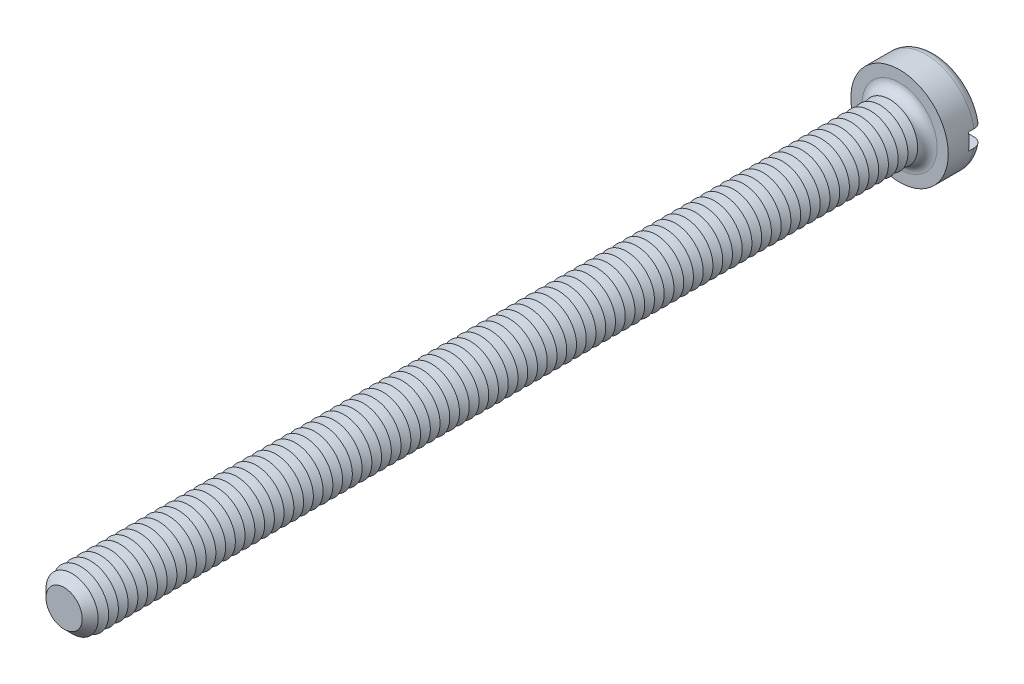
SolidWorks part; units mm, degrees
ref_plane "Front Plane" through (0, 0, 0) normal (0, 0, 1) x (1, 0, 0)
ref_plane "Top Plane" through (0, 0, 0) normal (0, 1, 0) x (1, 0, 0)
ref_plane "Right Plane" through (0, 0, 0) normal (1, 0, 0) x (0, 0, -1)
sketch "Sketch3" plane through (0, 0, 0) normal (0, 0, 1) x (1, 0, 0)
  circle A0 centre (0, 0) radius 3.5
  dimension "D1" = 7
extrude "Boss-Extrude2" add sketch "Sketch3" against normal blind 2.6
sketch "Sketch4" plane through (0, 0, 0) normal (0, 0, 1) x (1, 0, 0)
  circle A0 centre (0, 0) radius 2
  dimension "D1" = 4
extrude "Boss-Extrude3" add sketch "Sketch4" along normal blind 60
fillet "Fillet1" radius 0.7 2 edges at (3.5, 0, -2.6) (2, 0, 0)
chamfer "Chamfer1" distance 0.7 angle 45 1 edges at (2, 0, 60)
sketch "Sketch5" plane through (0, 0, 0) normal (1, 0, 0) x (0, 0, -1)
  line L0 (1.6944, 0) -> (-7.6738, 0) construction
sketch "Sketch6" plane through (0, 0, 0) normal (1, 0, 0) x (0, 0, -1)
  line L0 (-0.7, 2) -> (-1.05, 1.3938)
  line L1 (-1.05, 1.3938) -> (-1.4, 2)
  line L2 (-0.7, 2) -> (-59.3, 2) construction
  line L3 (-1.4, 2) -> (-0.7, 2)
  dimension "D1" = 0.7
revolve "Cut-Revolve1" cut sketch "Sketch6" angle 360 about L0
pattern_linear "LPattern1" count 84 spacing 0.7 along (0, 0, 1) of "Cut-Revolve1"
sketch "Sketch8" plane through (0, 0, -2.6) normal (0, 0, -1) x (-1, 0, 0)
  line L1 (3.5, -0.6) -> (-3.5, -0.6)
  line L2 (3.5, -0.6) -> (3.5, 0.6)
  line L3 (3.5, 0.6) -> (-3.5, 0.6)
  line L4 (-3.5, -0.6) -> (-3.5, 0.6)
  line L5 (3.5, -0.6) -> (-3.5, 0.6) construction
  line L6 (3.5, 0.6) -> (-3.5, -0.6) construction
  point P0 (0, 0)
  dimension "D1" = 7
  dimension "D2" = 1.2
extrude "Cut-Extrude1" cut sketch "Sketch8" against normal blind 1.1
